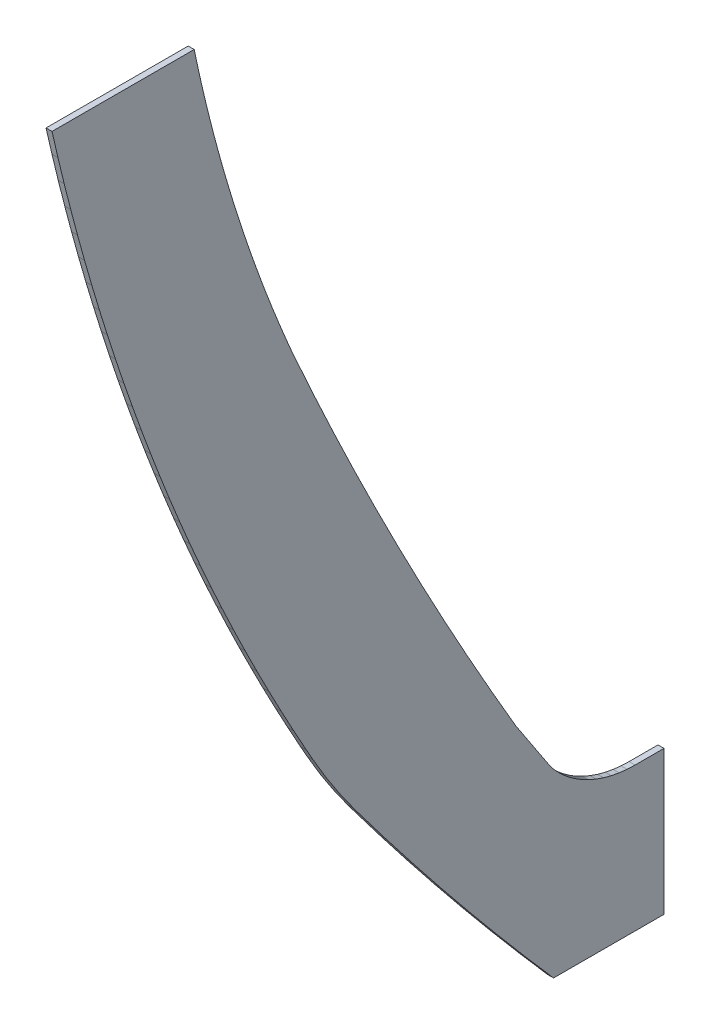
SolidWorks part; units mm, degrees
ref_plane "Plan de face" through (0, 0, 0) normal (0, 0, 1) x (1, 0, 0)
ref_plane "Plan de dessus" through (0, 0, 0) normal (0, 1, 0) x (1, 0, 0)
ref_plane "Plan de droite" through (0, 0, 0) normal (1, 0, 0) x (0, 0, -1)
ref_plane "Plan1" through (3023.0152, -0.7304, 3.0073) normal (1, -0.0002, 0.001) x (0.001, 0, -1)
sketch "Esquisse23" plane through (3023.0152, -0.7304, 3.0073) normal (1, -0.0002, 0.001) x (0.001, 0, -1)
  line L115 (-1017.7057, -9.2688) -> (-780.6086, -9.2704)
  line L116 (-780.6086, -9.2704) -> (-774.6375, -37.4103)
  line L117 (-774.6375, -37.4103) -> (-768.3664, -65.4849)
  line L118 (-768.3664, -65.4849) -> (-761.7962, -93.4909)
  line L119 (-761.7962, -93.4909) -> (-754.9273, -121.4253)
  line L120 (-754.9273, -121.4253) -> (-747.7608, -149.2847)
  line L121 (-747.7608, -149.2847) -> (-740.2974, -177.0661)
  line L122 (-740.2974, -177.0661) -> (-732.538, -204.7662)
  line L123 (-732.538, -204.7662) -> (-724.4833, -232.382)
  line L124 (-724.4833, -232.382) -> (-716.1344, -259.9102)
  line L125 (-716.1344, -259.9102) -> (-707.4922, -287.3478)
  line L126 (-707.4922, -287.3478) -> (-698.5577, -314.6916)
  line L127 (-698.5577, -314.6916) -> (-689.3319, -341.9385)
  line L128 (-689.3319, -341.9385) -> (-679.8159, -369.0853)
  line L129 (-679.8159, -369.0853) -> (-670.0106, -396.1291)
  line L130 (-670.0106, -396.1291) -> (-659.9173, -423.0667)
  line L131 (-659.9173, -423.0667) -> (-649.5372, -449.895)
  line L132 (-649.5372, -449.895) -> (-638.8713, -476.611)
  line L133 (-638.8713, -476.611) -> (-627.9209, -503.2117)
  line L134 (-627.9209, -503.2117) -> (-616.6873, -529.6941)
  line L135 (-616.6873, -529.6941) -> (-583.0971, -604.0862)
  line L136 (-583.0971, -604.0862) -> (-548.6741, -678.0974)
  line L137 (-548.6741, -678.0974) -> (-513.4241, -751.7183)
  line L138 (-513.4241, -751.7183) -> (-477.3517, -824.9397)
  line L139 (-477.3517, -824.9397) -> (-440.4614, -897.7525)
  line L140 (-440.4614, -897.7525) -> (-402.7578, -970.1474)
  line L141 (-402.7578, -970.1474) -> (-364.2456, -1042.1155)
  line L142 (-364.2456, -1042.1155) -> (-324.9298, -1113.6477)
  line L143 (-324.9298, -1113.6477) -> (-284.8151, -1184.7351)
  line L144 (-284.8151, -1184.7351) -> (-243.9067, -1255.3686)
  line L145 (-243.9067, -1255.3686) -> (-185.9406, -1343.2783)
  line L146 (-110.2193, -1398.9352) -> (-122.4414, -1393.6707)
  line L147 (-124.1545, -1392.8453) -> (-122.4414, -1393.6707)
  line L148 (-125.8588, -1392.002) -> (-124.1545, -1392.8453)
  line L149 (-127.554, -1391.1406) -> (-125.8588, -1392.002)
  line L150 (-129.2401, -1390.2614) -> (-127.554, -1391.1406)
  line L151 (-130.9168, -1389.3644) -> (-129.2401, -1390.2614)
  line L152 (-132.5839, -1388.4498) -> (-130.9168, -1389.3644)
  line L153 (-134.2413, -1387.5176) -> (-132.5839, -1388.4498)
  line L154 (-135.8887, -1386.568) -> (-134.2413, -1387.5176)
  line L155 (-137.526, -1385.601) -> (-135.8887, -1386.568)
  line L156 (-139.1529, -1384.6166) -> (-137.526, -1385.601)
  line L157 (-140.7694, -1383.6153) -> (-139.1529, -1384.6166)
  line L158 (-142.3753, -1382.5969) -> (-140.7694, -1383.6153)
  line L159 (-143.9703, -1381.5616) -> (-142.3753, -1382.5969)
  line L160 (-145.5542, -1380.5095) -> (-143.9703, -1381.5616)
  line L161 (-147.127, -1379.4407) -> (-145.5542, -1380.5095)
  line L162 (-148.6883, -1378.3554) -> (-147.127, -1379.4407)
  line L163 (-150.2382, -1377.2537) -> (-148.6883, -1378.3554)
  line L164 (-151.7763, -1376.1356) -> (-150.2382, -1377.2537)
  line L165 (-153.3024, -1375.0013) -> (-151.7763, -1376.1356)
  line L166 (-154.8166, -1373.851) -> (-153.3024, -1375.0013)
  line L167 (-156.3185, -1372.6848) -> (-154.8166, -1373.851)
  line L168 (-157.808, -1371.5027) -> (-156.3185, -1372.6848)
  line L169 (-159.2849, -1370.305) -> (-157.808, -1371.5027)
  line L170 (-160.7491, -1369.0918) -> (-159.2849, -1370.305)
  line L171 (-162.2004, -1367.8631) -> (-160.7491, -1369.0918)
  line L172 (-163.6386, -1366.6191) -> (-162.2004, -1367.8631)
  line L173 (-165.0636, -1365.3602) -> (-163.6386, -1366.6191)
  line L174 (-166.4752, -1364.0861) -> (-165.0636, -1365.3602)
  line L175 (-167.8733, -1362.7973) -> (-166.4752, -1364.0861)
  line L176 (-169.2577, -1361.4936) -> (-167.8733, -1362.7973)
  line L177 (-170.6282, -1360.1755) -> (-169.2577, -1361.4936)
  line L178 (-171.9848, -1358.843) -> (-170.6282, -1360.1755)
  line L179 (-173.3272, -1357.4963) -> (-171.9848, -1358.843)
  line L180 (-174.6553, -1356.1354) -> (-173.3272, -1357.4963)
  line L181 (-175.9689, -1354.7606) -> (-174.6553, -1356.1354)
  line L182 (-177.268, -1353.3719) -> (-175.9689, -1354.7606)
  line L183 (-178.5523, -1351.9696) -> (-177.268, -1353.3719)
  line L184 (-179.8217, -1350.5539) -> (-178.5523, -1351.9696)
  line L185 (-181.0761, -1349.1248) -> (-179.8217, -1350.5539)
  line L186 (-182.3153, -1347.6825) -> (-181.0761, -1349.1248)
  line L187 (-183.5392, -1346.2272) -> (-182.3153, -1347.6825)
  line L188 (-184.7477, -1344.7591) -> (-183.5392, -1346.2272)
  line L189 (-185.9406, -1343.2783) -> (-184.7477, -1344.7591)
  line L190 (-45.1715, -1411.0997) -> (3.0066, -1411.0997)
  line L191 (3.0066, -1411.0997) -> (3.0067, -1651.0997)
  line L192 (3.0067, -1651.0997) -> (-181.0542, -1651.0989)
  line L193 (-181.0542, -1651.0989) -> (-229.2132, -1595.5171)
  line L194 (-229.2132, -1595.5171) -> (-276.7709, -1539.4198)
  line L195 (-276.7709, -1539.4198) -> (-323.7216, -1482.8136)
  line L196 (-323.7216, -1482.8136) -> (-370.0599, -1425.705)
  line L197 (-370.0599, -1425.705) -> (-415.7804, -1368.1006)
  line L198 (-415.7804, -1368.1006) -> (-460.8778, -1310.007)
  line L199 (-460.8778, -1310.007) -> (-505.3469, -1251.4313)
  line L200 (-505.3469, -1251.4313) -> (-549.1825, -1192.3798)
  line L201 (-549.1825, -1192.3798) -> (-571.322, -1154.291)
  line L202 (-571.322, -1154.291) -> (-593.053, -1115.9686)
  line L203 (-593.053, -1115.9686) -> (-614.3736, -1077.4165)
  line L204 (-614.3736, -1077.4165) -> (-635.2814, -1038.639)
  line L205 (-635.2814, -1038.639) -> (-655.7741, -999.6404)
  line L206 (-655.7741, -999.6404) -> (-675.8493, -960.4253)
  line L207 (-675.8493, -960.4253) -> (-695.5047, -920.9981)
  line L208 (-695.5047, -920.9981) -> (-714.7381, -881.3634)
  line L209 (-714.7381, -881.3634) -> (-733.5473, -841.5256)
  line L210 (-733.5473, -841.5256) -> (-751.9301, -801.4892)
  line L211 (-751.9301, -801.4892) -> (-769.8845, -761.259)
  line L212 (-769.8845, -761.259) -> (-787.4084, -720.8393)
  line L213 (-787.4084, -720.8393) -> (-804.4997, -680.2348)
  line L214 (-804.4997, -680.2348) -> (-821.1566, -639.4502)
  line L215 (-821.1566, -639.4502) -> (-837.3772, -598.4901)
  line L216 (-837.3772, -598.4901) -> (-853.1596, -557.3592)
  line L217 (-853.1596, -557.3592) -> (-868.502, -516.0621)
  line L218 (-868.502, -516.0621) -> (-883.4026, -474.6036)
  line L219 (-883.4026, -474.6036) -> (-897.8598, -432.9884)
  line L220 (-897.8598, -432.9884) -> (-911.872, -391.2212)
  line L221 (-911.872, -391.2212) -> (-925.4374, -349.3068)
  line L222 (-925.4374, -349.3068) -> (-938.5546, -307.25)
  line L223 (-938.5546, -307.25) -> (-951.2221, -265.0555)
  line L224 (-951.2221, -265.0555) -> (-963.4384, -222.7283)
  line L225 (-963.4384, -222.7283) -> (-975.2022, -180.273)
  line L226 (-975.2022, -180.273) -> (-986.5121, -137.6945)
  line L227 (-986.5121, -137.6945) -> (-997.3668, -94.9978)
  line L228 (-997.3668, -94.9978) -> (-1007.7649, -52.1876)
  line L229 (-1007.7649, -52.1876) -> (-1017.7057, -9.2688)
  line L231 (-97.6416, -1403.2823) -> (-110.2193, -1398.9352)
  line L236 (-58.4702, -1410.6077) -> (-45.1715, -1411.0997)
  line L237 (-58.4702, -1410.6077) -> (-71.6961, -1409.1345)
  line L238 (-71.6961, -1409.1345) -> (-84.7771, -1406.6884)
  line L239 (-84.7771, -1406.6884) -> (-97.6416, -1403.2823)
  point P2 (0, 0)
  point P4 (-185.9406, -1343.2783)
extrude "Boss.-Extru.1" add sketch "Esquisse23" along normal blind 10
fillet "Congé1" radius 1000 2 edges at (3027.5057, -1344.0099, 188.9528) (3027.1808, -1193.1112, 552.1946)
